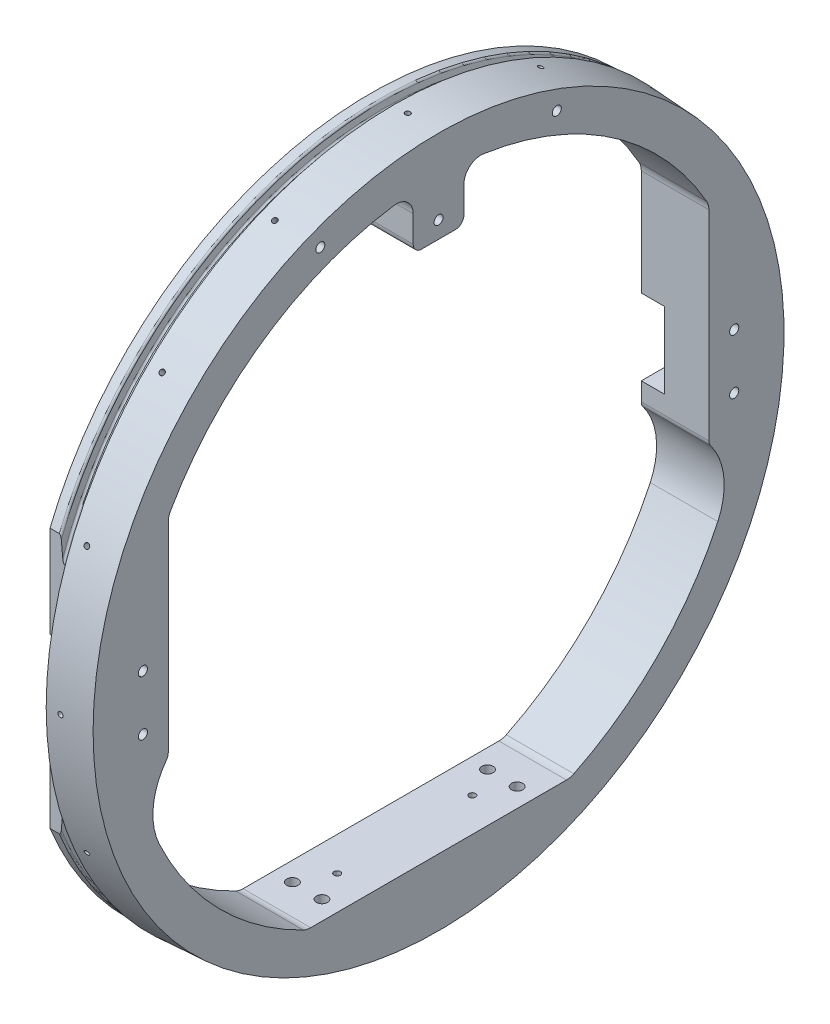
SolidWorks part; units mm, degrees
ref_plane "Front" through (0, 0, 0) normal (0, 0, 1) x (1, 0, 0)
ref_plane "Top" through (0, 0, 0) normal (0, 1, 0) x (1, 0, 0)
ref_plane "Right" through (0, 0, 0) normal (1, 0, 0) x (0, 0, -1)
sketch "Sketch1" plane through (0, 0, 0) normal (0, 0, 1) x (1, 0, 0)
  line L0 (0, 260.35) -> (0, 231.775)
  line L1 (0, 0) -> (182.79, 0) construction
  line L2 (8.4916, 259.1828) -> (9.565, 255.1766)
  line L3 (6.9704, 260.35) -> (0, 260.35)
  line L4 (17.4498, 255.5875) -> (17.4498, 261.62)
  line L5 (0, 231.775) -> (50.8, 231.775)
  line L6 (50.8, 231.775) -> (50.8, 259.715)
  line L7 (17.4498, 261.62) -> (50.8, 259.715)
  line L12 (15.8623, 254) -> (11.0984, 254)
  arc A0 (8.4916, 259.1828) -> (6.9704, 260.35) centre (6.9704, 258.7752) ccw
  arc A1 (15.8623, 254) -> (17.4498, 255.5875) centre (15.8623, 255.5875) ccw
  arc A2 (9.565, 255.1766) -> (11.0984, 254) centre (11.0984, 255.5875) ccw
  point P11 (8.1788, 260.35)
  dimension "D6" = 15
  dimension "D19" = 1.5875
  dimension "D20" = 1.5748
  dimension "D21" = 1.5875
  dimension "D3" = 231.775
  dimension "D4" = 17.4498
  dimension "D5" = 9.271
  dimension "D7" = 260.35
  dimension "D8" = 259.715
  dimension "D9" = 261.62
  dimension "D10" = 50.8
  dimension "D15" = 50.8
  dimension "D16" = 254
revolve "Revolve1" add sketch "Sketch1" angle 360 about L1
sketch "Sketch2" plane through (0, 0, 0) normal (-1, 0, 0) x (0, 0, 1)
  line L0 (203.2, 111.4873) -> (203.2, -44.45)
  line L1 (0, 0) -> (0, 120.4975) construction
  line L2 (-99.0376, -209.55) -> (99.0376, -209.55)
  line L6 (-203.2, -44.45) -> (-222.7606, -64.0106)
  line L7 (-203.2, 111.4873) -> (-203.2, -44.45)
  line L8 (203.2, -44.45) -> (222.7606, -64.0106)
  circle A0 centre (0, 0) radius 231.775 construction
  arc A1 (-222.7606, -64.0106) -> (-203.2, 111.4873) centre (0, 0) cw
  arc A2 (222.7606, -64.0106) -> (203.2, 111.4873) centre (0, 0) ccw
  arc A4 (99.0376, -209.55) -> (-99.0376, -209.55) centre (0, 0) cw
  dimension "D3" = 209.55
  dimension "D2" = 203.2
  dimension "D7" = 44.45
  dimension "D8" = 45
extrude "Extrude1" add sketch "Sketch2" against normal up to surface (50.8 mm away)
sketch "Sketch4" plane through (0, 0, 0) normal (-1, 0, 0) x (0, 0, 1)
  line L0 (-241.3, 97.757) -> (-241.3, 28.575)
  line L1 (-241.3, 28.575) -> (241.3, 28.575)
  line L2 (-241.3, -28.575) -> (-241.3, -97.757)
  line L3 (-241.3, -28.575) -> (241.3, -28.575)
  line L4 (0, 0) -> (0, -113.7612) construction
  line L5 (241.3, -28.575) -> (241.3, -97.757)
  line L6 (241.3, 97.757) -> (241.3, 28.575)
  circle A0 centre (0, 0) radius 260.35 construction
  arc A1 (241.3, 97.757) -> (241.3, -97.757) centre (0, 0) cw
  arc A2 (-241.3, 97.757) -> (-241.3, -97.757) centre (0, 0) ccw
  arc A3 (203.2, 111.4873) -> (-203.2, 111.4873) centre (0, 0) ccw construction
  dimension "D1" = 28.575
  dimension "D2" = 28.575
  dimension "D3" = 241.3
extrude "Clamp tabs cut" cut sketch "Sketch4" against normal blind 17.4498
sketch "Sketch7" plane through (17.4498, 0, 0) normal (-1, 0, 0) x (0, 0, 1)
  line L0 (0, 0) -> (0, -61.406) construction
  circle A0 centre (-222.25, 20.6375) radius 3.4544
  circle A1 centre (-222.25, -20.6375) radius 3.4544
  circle A2 centre (222.25, -20.6375) radius 3.4544
  circle A3 centre (222.25, 20.6375) radius 3.4544
  dimension "D1" = 222.25
  dimension "D2" = 20.6375
  dimension "D3" = 20.6375
  dimension "D4" = 6.9088
extrude "Clamp tabs holes" cut sketch "Sketch7" against normal through all
fillet "big Fillet1" radius 50.8 4 edges at (25.4, -64.0106, 222.7606) (25.4, 111.4873, 203.2) (25.4, -64.0106, -222.7606) (25.4, 111.4873, -203.2)
hole_wizard "CBORE for #10 Socket Head Cap Screw2" positions "Sketch10" profile "Sketch9" counterbore size "#10" standard "Ansi Inch"
sketch "Sketch10" plane through (0, 0, 0) normal (-1, 0, 0) x (0, 0, 1)
  line L0 (-206.375, 73.025) -> (206.375, 73.025) construction
  line L1 (-206.375, -41.275) -> (206.375, -41.275) construction
  point P0 (-206.375, 73.025)
  point P1 (206.375, 73.025)
  point P2 (206.375, -41.275)
  point P3 (-206.375, -41.275)
  point P8 (0, -41.275)
  point P10 (0, 73.025)
  dimension "D1" = 412.75
  dimension "D2" = 114.3
  dimension "D3" = 41.275
  dimension "D4" = 412.75
sketch "Sketch9" plane through (0, 73.025, -206.375) normal (0, 1, 0) x (0, 0, 1)
  line L0 (0, 0) -> (0, 50.8)
  line L1 (0, 50.8) -> (2.5527, 50.8)
  line L3 (2.5527, 50.8) -> (2.5527, 4.826)
  line L4 (2.5527, 4.826) -> (4.7625, 4.826)
  line L5 (4.7625, 4.826) -> (4.7625, 0)
  line L7 (4.7625, 0) -> (0, 0)
  line L11 (0, -6.35) -> (0, 107.95) construction
  dimension "Thru Hole Dia." = 5.1054
  dimension "Thru Hole Depth" = 50.8
  dimension "C'Bore Dia." = 9.525
  dimension "C'Bore Depth" = 4.826
hole_wizard "#10-24 Tapped Hole1" positions "Sketch12" profile "Sketch11" tap size "#10-24" standard "Ansi Inch"
sketch "Sketch12" plane through (0, -209.55, 0) normal (0, 1, 0) x (-1, 0, 0)
  line L0 (-25.4, -50.8) -> (-25.4, 50.8) construction
  line L1 (0, 99.0376) -> (0, -99.0376) construction
  point P0 (-25.4, -50.8)
  point P1 (-25.4, 50.8)
  point P4 (-25.4, 0)
  point P8 (0, 0)
  dimension "D1" = 101.6
  dimension "D2" = 25.4
sketch "Sketch11" plane through (25.4, -209.55, -50.8) normal (1, 0, 0) x (0, 0, 1)
  line L0 (0, 0) -> (0, 17.0184)
  line L1 (0, 17.0184) -> (1.8986, 15.8775)
  line L2 (1.8986, 15.8775) -> (1.8986, 12.7)
  line L3 (1.8986, 12.7) -> (2.413, 12.7)
  line L4 (2.413, 12.7) -> (2.413, 0)
  line L5 (2.413, 0) -> (0, 0)
  line L10 (0, 17.0184) -> (-1.8987, 15.8775) construction
  line L11 (0, -6.35) -> (0, 107.95) construction
  dimension "Tap Drill Dia." = 3.7973
  dimension "Tap Drill Depth" = 15.8775
  dimension "Thread Major Dia." = 4.826
  dimension "Thread Depth" = 12.7
  dimension "Drill Angle" = 118
ref_plane "Plane1" through (34.1249, -260.6675, 0) normal (0.057, -0.9984, 0) x (0, 0, -1)
sketch "Sketch13" plane through (34.1249, -260.6675, 0) normal (0.057, -0.9984, 0) x (0, 0, -1)
  circle A0 centre (0, -6.504) radius 1.905
  dimension "D1" = 3.81
  dimension "D2" = 12.7
extrude "#10-24 Tap" cut sketch "Sketch13" against normal blind 19.05
pattern_circular "CirPattern1" count 16 over 360 about axis through (0, 0, 0) along (1, 0, 0) of "#10-24 Tap"
hole_wizard "Q (0.332) Diameter Hole1" positions "Sketch15" profile "Sketch14" hole size "Q" standard "Ansi Inch"
sketch "Sketch15" plane through (0, -209.55, 0) normal (0, 1, 0) x (-1, 0, 0)
  line L1 (-50.8, -99.0376) -> (-50.8, 99.0376) construction
  point P0 (-14.2875, 73.3425)
  point P1 (-36.5125, 73.3425)
  point P8 (-36.5125, -73.3552)
  point P9 (-14.2875, -73.3552)
  dimension "D1" = 14.2875
  dimension "D2" = 22.225
  dimension "D3" = 73.3425
  dimension "D4" = 73.3552
sketch "Sketch14" plane through (14.2875, -209.55, 73.3425) normal (1, 0, 0) x (0, 0, 1)
  line L0 (0, 0) -> (0, 21.5835)
  line L1 (0, 21.5835) -> (4.2164, 19.05)
  line L2 (4.2164, 19.05) -> (4.2164, 0)
  line L5 (4.2164, 0) -> (0, 0)
  line L10 (0, 21.5835) -> (-4.2164, 19.05) construction
  line L11 (0, -6.35) -> (0, 107.95) construction
  dimension "Hole Dia." = 8.4328
  dimension "Hole Depth" = 19.05
  dimension "Drill Angle" = 118
sketch "Sketch17" plane through (50.8, 0, 0) normal (1, 0, 0) x (0, 0, -1)
  line L0 (99.0376, -209.55) -> (-99.0376, -209.55) construction
  line L1 (-381, 298.45) -> (381, 298.45)
  line L2 (-381, 298.45) -> (-381, -209.55)
  line L3 (-381, -209.55) -> (381, -209.55)
  line L4 (381, 298.45) -> (381, -209.55)
  point P6 (0, 298.45)
  dimension "D1" = 762
  dimension "D2" = 508
extrude "Cut-Extrude1" [suppressed] cut sketch "Sketch17" against normal blind 12.7
sketch "Sketch18" plane through (0, 0, 0) normal (1, 0, 0) x (0, 0, -1)
  line L2 (19.05, 230.9908) -> (19.05, 190.5)
  line L3 (19.05, 190.5) -> (-19.05, 190.5)
  line L4 (-19.05, 230.9908) -> (-19.05, 190.5)
  arc A0 (195.1789, 124.9993) -> (-195.1789, 124.9993) centre (0, 0) ccw construction
  arc A1 (19.05, 230.9908) -> (-19.05, 230.9908) centre (0, 0) ccw
  point P7 (0, 190.5)
  dimension "D1" = 38.1
  dimension "D2" = 190.5
extrude "top tab" add sketch "Sketch18" along normal up to surface (50.8 mm away)
sketch "Sketch19" plane through (0, 0, 0) normal (1, 0, 0) x (0, 0, -1)
  line L0 (-203.2, 97.6022) -> (-203.2, 28.575) construction
  line L1 (202.1349, 107.95) -> (165.1, 107.95)
  line L3 (203.2, 69.85) -> (165.1, 69.85)
  line L4 (165.1, 107.95) -> (165.1, 69.85)
  line L5 (-202.1349, 107.95) -> (-165.1, 107.95)
  line L7 (-203.2, 69.85) -> (-165.1, 69.85)
  line L8 (-165.1, 107.95) -> (-165.1, 69.85)
  line L9 (203.2, 28.575) -> (203.2, 97.6022) construction
  line L10 (-203.2, 97.6022) -> (-203.2, 69.85)
  line L11 (203.2, 69.85) -> (203.2, 97.6022)
  line L12 (165.1, 88.9) -> (-165.1, 88.9) construction
  arc A0 (-195.1789, 124.9993) -> (-203.2, 97.6022) centre (-152.4, 97.6022) ccw construction
  arc A1 (-19.05, 230.9908) -> (-195.1789, 124.9993) centre (0, 0) ccw construction
  arc A2 (203.2, 97.6022) -> (195.1789, 124.9993) centre (152.4, 97.6022) ccw construction
  arc A4 (-202.1349, 107.95) -> (-203.2, 97.6022) centre (-152.4, 97.6022) ccw
  arc A6 (203.2, 97.6022) -> (202.1349, 107.95) centre (152.4, 97.6022) ccw
  point P21 (0, 88.9)
  dimension "D1" = 330.2
  dimension "D2" = 88.9
  dimension "D3" = 38.1
extrude "side tabs" add sketch "Sketch19" along normal up to surface (50.8 mm away)
fillet "Inside corner Fillet r=.5" radius 12.7 8 edges at (25.4, 69.85, 203.2) (25.4, 230.9908, 19.05) (25.4, 230.9908, -19.05) (25.4, 69.85, -203.2) (25.4, -209.55, -99.0376) (25.4, -209.55, 99.0376) (25.4, 107.95, 202.1349) (25.4, 107.95, -202.1349)
fillet "outside corner fillet r=.25" radius 6.35 8 edges at (25.4, -44.45, 203.2) (25.4, 69.85, 165.1) (25.4, 190.5, 19.05) (25.4, 190.5, -19.05) (25.4, 69.85, -165.1) (25.4, -44.45, -203.2) (25.4, 107.95, 165.1) (25.4, 107.95, -165.1)
hole_wizard "CBORE for 1/4 Socket Head Cap Screw1" positions "Sketch21" profile "Sketch20" counterbore size "1/4" standard "Ansi Inch"
sketch "Sketch21" plane through (0, 0, 0) normal (-1, 0, 0) x (0, 0, 1)
  line L0 (-180.975, 88.9) -> (180.975, 88.9) construction
  line L1 (0, 310.5368) -> (0.0015, 54.7815) construction
  circle A0 centre (0, 0) radius 246.38 construction
  point P0 (-180.975, 88.9)
  point P1 (0, 203.2)
  point P2 (180.975, 88.9)
  point P5 (0, 88.9)
  point P11 (-88.8995, 229.7825)
  point P20 (88.9005, 229.7835)
  dimension "D4" = 492.76
  dimension "D1" = 361.95
  dimension "D2" = 88.9
  dimension "D3" = 203.2
  dimension "D5" = 88.9
sketch "Sketch20" plane through (0, 88.9, -180.975) normal (0, 1, 0) x (0, 0, 1)
  line L0 (0, 0) -> (0, 50.8)
  line L1 (0, 50.8) -> (3.3782, 50.8)
  line L3 (3.3782, 50.8) -> (3.3782, 6.35)
  line L4 (3.3782, 6.35) -> (5.5562, 6.35)
  line L5 (5.5562, 6.35) -> (5.5562, 0)
  line L7 (5.5562, 0) -> (0, 0)
  line L11 (0, -6.35) -> (0, 107.95) construction
  dimension "Thru Hole Dia." = 6.7564
  dimension "Thru Hole Depth" = 50.8
  dimension "C'Bore Dia." = 11.1125
  dimension "C'Bore Depth" = 6.35
sketch "Sketch22" plane through (0, 0, 0) normal (-1, 0, 0) x (0, 0, 1)
  line L0 (33.5906, 229.328) -> (33.5906, 181.1773)
  line L1 (33.5906, 181.1773) -> (-33.5906, 181.1773)
  line L2 (-33.5906, 181.1773) -> (-33.5906, 229.328)
  line L3 (-203.8483, 110.2974) -> (-203.2, 57.15)
  line L4 (-203.2, 57.15) -> (-149.7732, 57.15)
  line L5 (-149.7732, 57.15) -> (-149.7732, 127.6442)
  line L6 (-149.7732, 127.6442) -> (-193.4596, 127.6442)
  line L7 (203.8483, 110.2974) -> (203.2, 57.15)
  line L8 (203.2, 57.15) -> (150.5785, 57.15)
  line L9 (150.5785, 57.15) -> (150.5785, 127.6442)
  line L10 (150.5785, 127.6442) -> (193.4596, 127.6442)
  line L11 (-101.719, -208.2616) -> (101.719, -208.2616)
  arc A0 (-33.5906, 229.328) -> (33.5906, 229.328) centre (0, 0) cw
  arc A1 (193.4596, 127.6442) -> (33.5906, 229.328) centre (0, 0) ccw construction
  arc A2 (-193.4596, 127.6442) -> (-203.8483, 110.2974) centre (0, 0) ccw
  arc A3 (193.4596, 127.6442) -> (203.8483, 110.2974) centre (0, 0) cw
  arc A4 (-101.719, -208.2616) -> (101.719, -208.2616) centre (0, 0) ccw
  arc A5 (101.719, -208.2616) -> (209.9447, -98.1981) centre (0, 0) ccw construction
extrude "Cut-Extrude2" [suppressed] cut sketch "Sketch22" against normal through all
sketch "Sketch23" plane through (0, 0, 0) normal (-1, 0, 0) x (0, 0, 1)
  line L0 (-203.2, 28.575) -> (-203.2, 57.15) construction
  line L1 (-203.2, 28.575) -> (-203.2, 111.4873)
  line L2 (-167.1962, 160.5151) -> (-130.8245, 160.5151)
  line L3 (-130.8245, 160.5151) -> (-130.8245, 28.575)
  line L4 (-130.8245, 28.575) -> (-203.2, 28.575)
  line L5 (0, 322.3601) -> (0, -86.2121) construction
  line L6 (130.8245, 28.575) -> (203.2, 28.575)
  line L7 (130.8245, 160.5151) -> (130.8245, 28.575)
  line L8 (167.1962, 160.5151) -> (130.8245, 160.5151)
  line L9 (203.2, 28.575) -> (203.2, 111.4873)
  arc A0 (-167.1962, 160.5151) -> (-203.2, 111.4873) centre (0, 0) ccw
  arc A1 (-33.5906, 229.328) -> (-193.4596, 127.6442) centre (0, 0) ccw construction
  arc A2 (167.1962, 160.5151) -> (203.2, 111.4873) centre (0, 0) cw
extrude "Cut-Extrude3" cut sketch "Sketch23" against normal through all
fillet "Fillet1" radius 12.7 2 edges at (25.4, 111.4873, 203.2) (25.4, 111.4873, -203.2)
